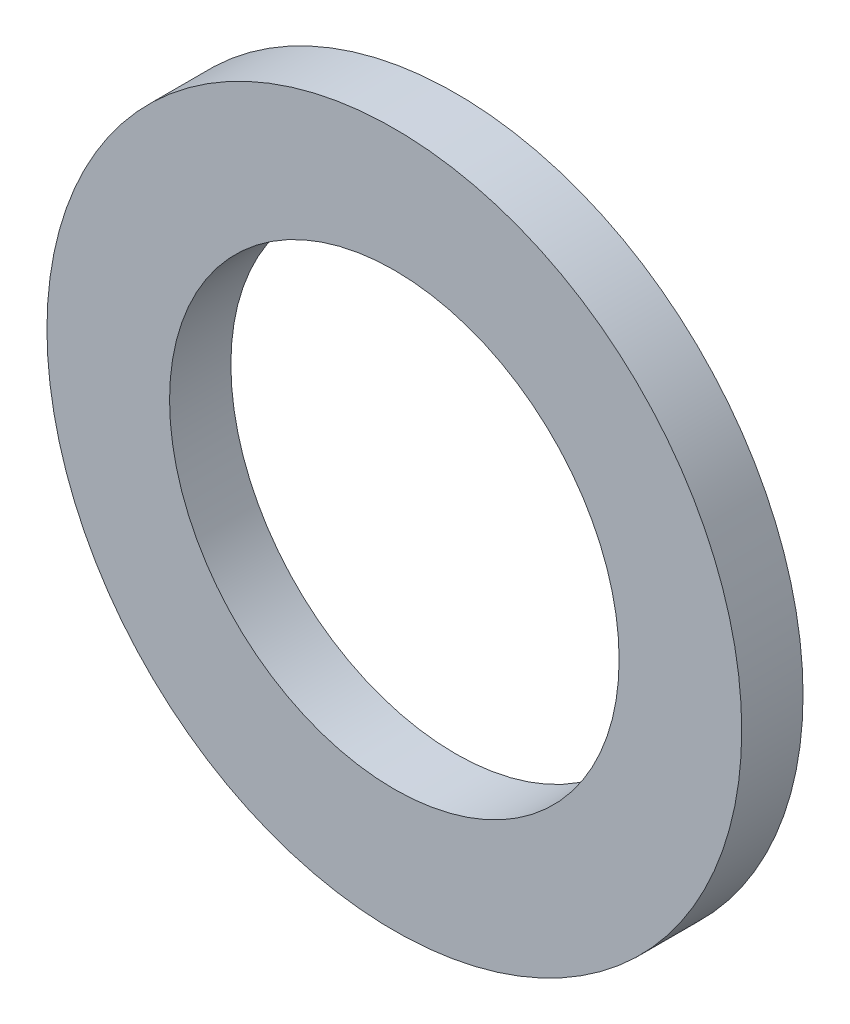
SolidWorks part; units mm, degrees
ref_plane "Face" through (0, 0, 0) normal (0, 0, 1) x (1, 0, 0)
ref_plane "Dessus" through (0, 0, 0) normal (0, 1, 0) x (1, 0, 0)
ref_plane "Droite" through (0, 0, 0) normal (1, 0, 0) x (0, 0, -1)
sketch "Esquisse1" plane through (0, 0, 0) normal (0, 0, 1) x (1, 0, 0)
  circle A0 centre (0, 0) radius 17
  circle A1 centre (0, 0) radius 11
  dimension "D1" = 22
  dimension "D2" = 34
extrude "Extrusion1" add sketch "Esquisse1" along normal blind 3
